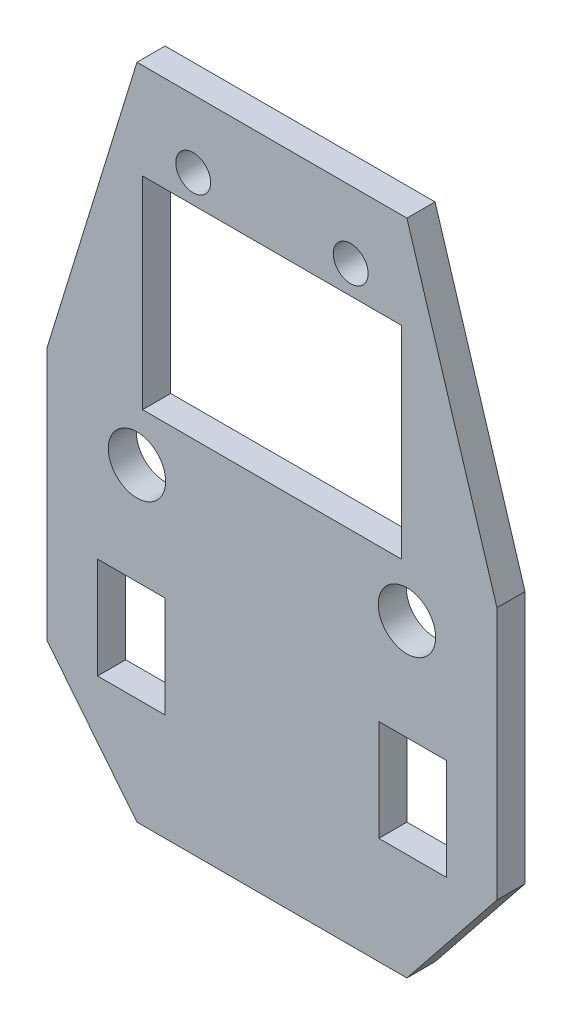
SolidWorks part; units mm, degrees
ref_plane "前视基准面" through (0, 0, 0) normal (0, 0, 1) x (1, 0, 0)
ref_plane "上视基准面" through (0, 0, 0) normal (0, 1, 0) x (1, 0, 0)
ref_plane "右视基准面" through (0, 0, 0) normal (1, 0, 0) x (0, 0, -1)
other "Configuration Table"
sketch "草图1" plane through (0, 0, 0) normal (0, 0, 1) x (1, 0, 0)
  line L0 (-40, -35) -> (-24, -55)
  line L1 (-24, -55) -> (24, -55)
  line L2 (24, -55) -> (40, -35)
  line L3 (40, -35) -> (40, 10)
  line L4 (40, 10) -> (24, 62)
  line L5 (24, 62) -> (-24, 62)
  line L6 (-24, 62) -> (-40, 10)
  line L7 (-40, 10) -> (-40, -35)
  dimension "D1" = 24
  dimension "D2" = 40
  dimension "D3" = 24
  dimension "D4" = 10
  dimension "D5" = 62
  dimension "D6" = 35
  dimension "D7" = 55
extrude "Palm_Frame" add sketch "草图1" against normal mid plane 5
sketch "草图2" plane through (0, 0, 0) normal (0, 0, 1) x (1, 0, 0)
  circle A0 centre (-24, 0) radius 5.1
  circle A1 centre (24, 0) radius 5.1
  circle A2 centre (-14, 50) radius 3.1
  circle A3 centre (14, 50) radius 3.1
  dimension "D1" = 10.2
  dimension "D2" = 6.2
  dimension "D3" = 14
  dimension "D4" = 24
  dimension "D5" = 14
  dimension "D6" = 24
  dimension "D7" = 50
extrude "Ground_Pivot_Bores" cut sketch "草图2" against normal mid plane 500
sketch "草图3" plane through (0, 0, 0) normal (0, 0, 1) x (1, 0, 0)
  line L1 (-23, 9) -> (23, 9)
  line L2 (-23, 9) -> (-23, 45)
  line L3 (-23, 45) -> (23, 45)
  line L4 (23, 9) -> (23, 45)
  line L5 (-23, 9) -> (23, 45) construction
  line L6 (-23, 45) -> (23, 9) construction
  line L7 (-31, -36) -> (-19, -36)
  line L8 (-31, -36) -> (-31, -18)
  line L9 (-31, -18) -> (-19, -18)
  line L10 (-19, -36) -> (-19, -18)
  line L11 (-31, -36) -> (-19, -18) construction
  line L12 (-31, -18) -> (-19, -36) construction
  line L13 (19, -36) -> (31, -36)
  line L14 (19, -36) -> (19, -18)
  line L15 (19, -18) -> (31, -18)
  line L16 (31, -36) -> (31, -18)
  line L17 (19, -36) -> (31, -18) construction
  line L18 (19, -18) -> (31, -36) construction
  point P0 (0, 27)
  point P5 (-25, -27)
  point P10 (25, -27)
  dimension "D1" = 19
  dimension "D2" = 23
  dimension "D3" = 25
  dimension "D4" = 9
  dimension "D5" = 27
  dimension "D6" = 18
extrude "Linkage_Inspection_Windows" cut sketch "草图3" against normal mid plane 500
